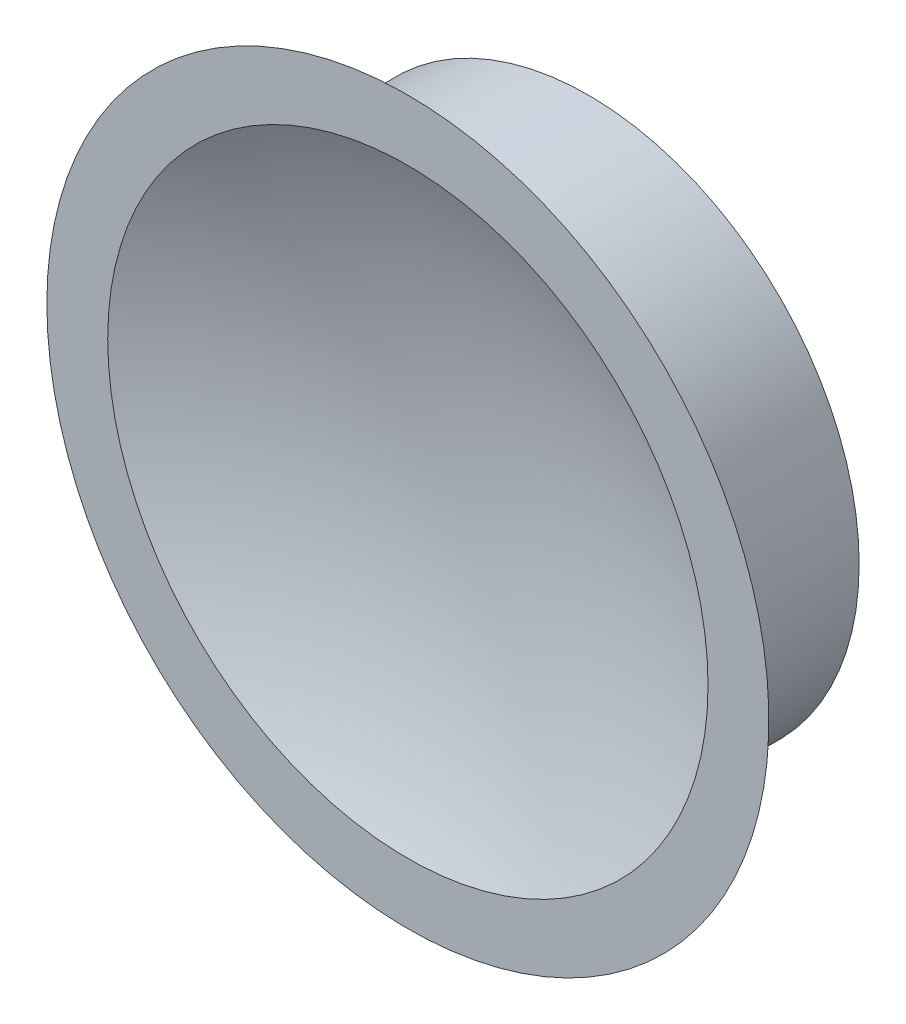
SolidWorks part; units mm, degrees
ref_plane "Front Plane" through (0, 0, 0) normal (0, 0, 1) x (1, 0, 0)
ref_plane "Top Plane" through (0, 0, 0) normal (0, 1, 0) x (1, 0, 0)
ref_plane "Right Plane" through (0, 0, 0) normal (1, 0, 0) x (0, 0, -1)
sketch "Sketch1" plane through (0, 0, 0) normal (0, 1, 0) x (1, 0, 0)
  line L0 (3.175, 1.5494) -> (3.175, 6.35)
  line L1 (3.175, 6.35) -> (12.7, 6.35)
  line L2 (22.225, 6.35) -> (22.225, 1.5494)
  line L4 (12.7, 0) -> (12.7, 6.35) construction
  line L5 (12.7, 6.35) -> (22.225, 6.35)
  line L6 (0, 0) -> (2.1411, 0)
  line L7 (23.2589, 0) -> (25.4, 0)
  line L8 (2.1411, 0) -> (12.7, 0) construction
  line L9 (12.7, 0) -> (23.2589, 0) construction
  line L10 (12.7, 6.35) -> (12.7, 2.403)
  arc A0 (0, 0) -> (3.175, 1.5494) centre (12.7, -21.997) cw
  arc A1 (2.1411, 0) -> (23.2589, 0) centre (12.7, -21.997) cw
  arc A2 (0.5, -0.866) -> (24.9, -0.866) centre (12.7, -21.997) cw construction
  arc A3 (22.225, 1.5494) -> (25.4, 0) centre (12.7, -21.997) cw
  arc A4 (0, 0) -> (25.4, 0) centre (12.7, -21.997) cw construction
  dimension "D3" = 25.4
  dimension "D5" = 24.4
  dimension "D1" = 25.4
  dimension "D2" = 6.35
  dimension "D4" = 9.525
revolve "Revolve3" add sketch "Sketch1" angle 360 about L4
